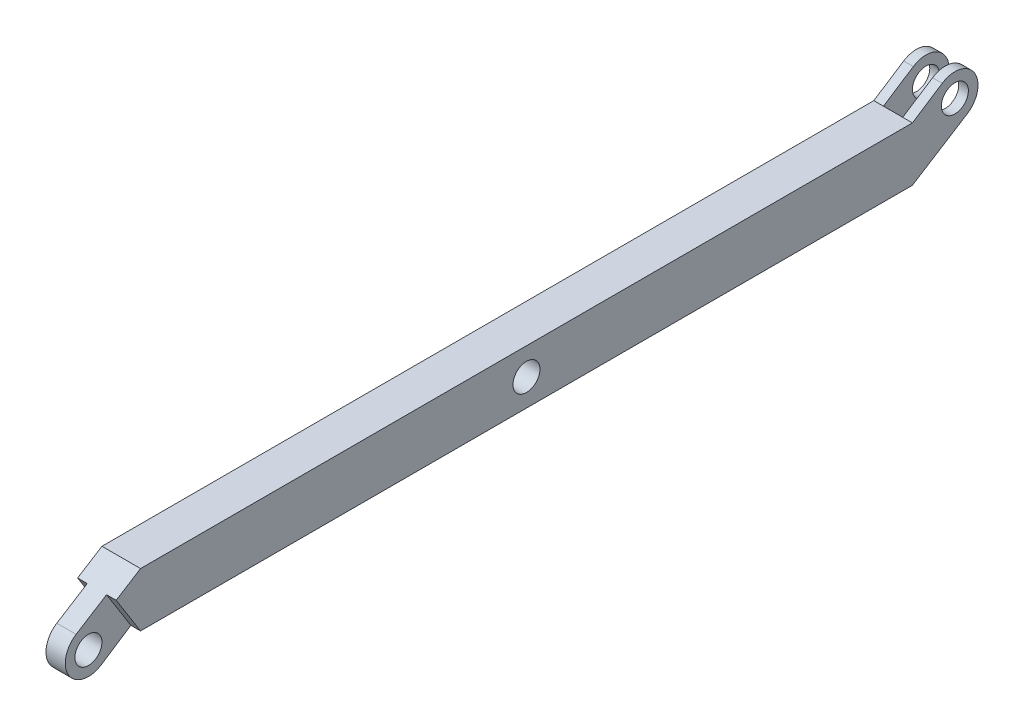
SolidWorks part; units mm, degrees
ref_plane "Plane1" through (0, 0, 0) normal (0, 0, 1) x (1, 0, 0)
ref_plane "Plane2" through (0, 0, 0) normal (0, 1, 0) x (1, 0, 0)
ref_plane "Plane3" through (0, 0, 0) normal (1, 0, 0) x (0, 0, -1)
sketch "Sketch1" plane through (0, 0, 0) normal (0, 0, 1) x (1, 0, 0)
  line L0 (-50, -70) -> (50, -70)
  line L1 (-50, -70) -> (-50, 70)
  line L2 (50, 70) -> (-50, 70)
  line L3 (50, 70) -> (50, -70)
  line L4 (-40, 60) -> (40, 60)
  line L5 (-40, 60) -> (-40, -60)
  line L6 (40, -60) -> (-40, -60)
  line L7 (40, -60) -> (40, 60)
  point P8 (50, 0)
  point P9 (0, -70)
  dimension "D1" = 140
  dimension "D2" = 100
  dimension "D3" = 10
  dimension "D4" = 10
  dimension "D5" = 10
  dimension "D6" = 10
extrude "Base-Extrude" add sketch "Sketch1" along normal mid plane 2000
ref_plane "Plane5" through (0, 0, 0) normal (-1, 0, 0) x (0, 0, 1)
extrude "Boss-Extrude1" add sketch "Sketch4" along normal mid plane 50
sketch "Sketch4" plane through (0, 0, 0) normal (1, 0, 0) x (0, 0, -1)
  line L1 (-1000, -70) -> (1000, -70) construction
  line L2 (-1000, 70) -> (-1000, -70)
  line L4 (-1000, -70) -> (-1077.2727, -120.2884)
  line L5 (-1000, 70) -> (-1141.9273, -19.1999)
  arc A0 (-1141.9273, -19.1999) -> (-1077.2727, -120.2884) centre (-1110, -70) ccw
  circle A1 centre (-1110, -70) radius 35
  dimension "D2" = 70
  dimension "D3" = 60
  dimension "D1" = 110
extrude "Boss-Extrude3" add sketch "Sketch7" along normal mid plane 100
sketch "Sketch7" plane through (0, 0, 0) normal (-1, 0, 0) x (0, 0, 1)
  line L0 (1000, -70) -> (-1000, -70) construction
  line L1 (1000, 70) -> (-1000, 70) construction
  line L2 (-960, 70) -> (-960, -70)
  line L3 (-960, -70) -> (-1000, -70)
  line L4 (-1000, -70) -> (-1141.9273, 19.1999)
  line L5 (-1000, 70) -> (-1077.2727, 120.2884)
  line L6 (-960, 70) -> (-1000, 70)
  line L7 (-1000, -70) -> (-1000, 70) construction
  arc A0 (-1077.2727, 120.2884) -> (-1141.9273, 19.1999) centre (-1110, 70) ccw
  circle A1 centre (-1110, 70) radius 35
  dimension "D2" = 70
  dimension "D3" = 60
  dimension "D1" = 40
  dimension "D4" = 70
  dimension "D5" = 110
sketch "Sketch6" plane through (40, 0, 0) normal (-1, 0, 0) x (0, 0, 1)
  circle A0 centre (0, 0) radius 42.5
  dimension "D1" = 85
extrude "Boss-Extrude2" add sketch "Sketch6" along normal up to surface (80 mm away)
sketch "Sketch5" plane through (50, 0, 0) normal (1, 0, 0) x (0, 0, -1)
  circle A0 centre (0, 0) radius 35
  circle A1 centre (-1110, -70) radius 35 construction
extrude "Cut-Extrude1" cut sketch "Sketch5" against normal through all
sketch "Sketch8" plane through (0, 0, 0) normal (1, 0, 0) x (0, 0, -1)
  line L0 (1000, 70) -> (1063.0743, -30.3584)
  line L1 (1000, -70) -> (1141.9273, 19.1999) construction
  line L2 (1000, 70) -> (1077.2727, 120.2884) construction
  line L4 (1000, 70) -> (1127.5612, 153.0157)
  line L5 (1127.5612, 153.0157) -> (1193.5378, 51.6366)
  line L7 (1000, -70) -> (1141.9273, 19.1999) construction
  line L8 (1063.0743, -30.3584) -> (1193.5378, 51.6366)
  arc A0 (1141.9273, 19.1999) -> (1077.2727, 120.2884) centre (1110, 70) ccw construction
extrude "Cut-Extrude2" cut sketch "Sketch8" against normal mid plane 50
sketch "Sketch10" plane through (0, 0, 0) normal (-1, 0, 0) x (0, 0, 1)
  line L0 (1000, 70) -> (-1000, 70) construction
  line L1 (1000, -70) -> (-1000, -70) construction
  line L2 (1000, 70) -> (1141.9273, -19.1999) construction
  line L4 (1000, -70) -> (1063.0743, 30.3584)
  line L5 (1063.0743, 30.3584) -> (1000, 70)
  line L8 (1000, 70) -> (950, 70)
  line L9 (1000, -70) -> (1077.2727, -120.2884) construction
  line L10 (1000, -70) -> (950, -70)
  line L11 (950, 70) -> (950, -70)
  dimension "D2" = 50
extrude "Boss-Extrude4" add sketch "Sketch10" along normal mid plane 100
ref_point "Point1"
ref_point "Point2"
